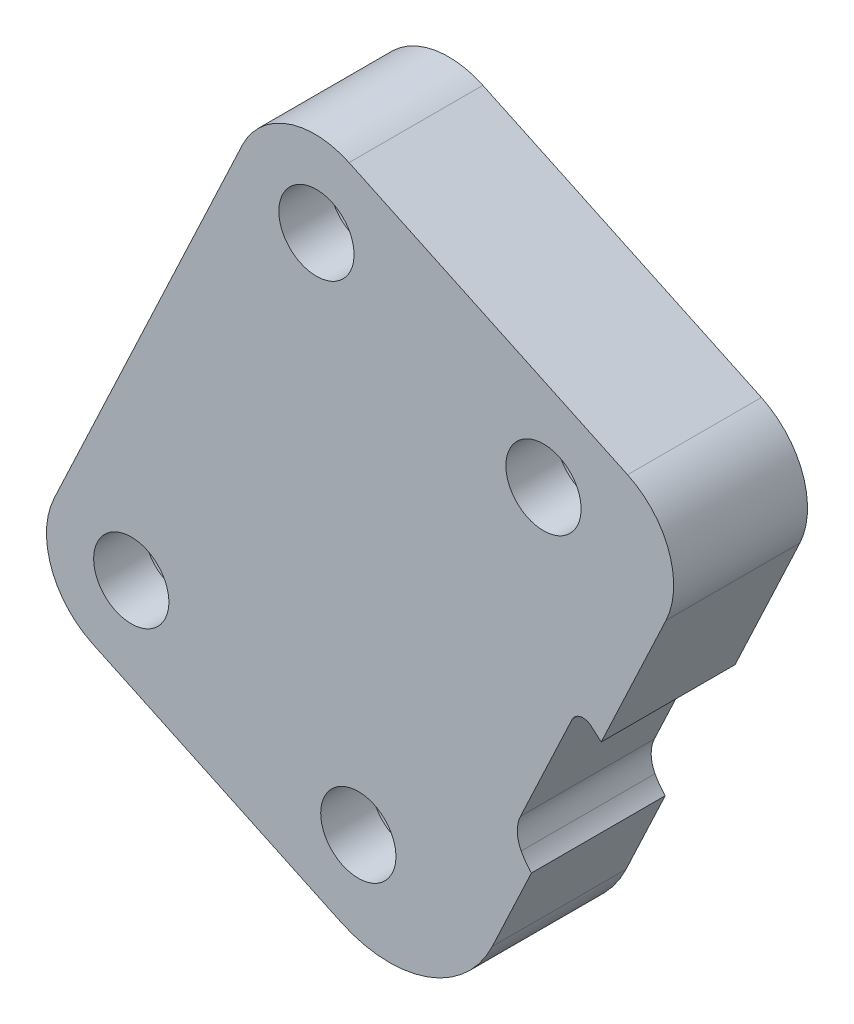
SolidWorks part; units mm, degrees
ref_plane "Front" through (0, 0, 0) normal (0, 0, 1) x (1, 0, 0)
ref_plane "Top" through (0, 0, 0) normal (0, 1, 0) x (1, 0, 0)
ref_plane "Right" through (0, 0, 0) normal (1, 0, 0) x (0, 0, -1)
ref_plane "Plane1"
sketch "Sketch1" plane through (0, 0, 3.2) normal (0, 0, -1) x (-1, 0, 0)
  line L0 (347.0241, 7.1484) -> (363.5162, -27.9003)
  line L1 (350.6746, 17.2876) -> (377.1047, 29.7243)
  line L2 (377.8801, -33.0718) -> (401.4374, -21.9869)
  line L3 (387.2439, 26.0738) -> (405.0878, -11.8477)
  line L4 (375.8975, -10.9615) -> (369.3196, 3.0178) construction
  line L5 (360.5195, -15.5659) -> (355.9692, -5.8959) construction
  line L6 (360.5195, -15.5659) -> (355.9692, -5.8959) construction
  line L8 (358.2444, -10.7309) -> (386.4628, 2.5473) construction
  arc A0 (377.1047, 29.7243) -> (387.2439, 26.0738) centre (380.3491, 22.8295) cw
  arc A1 (401.4374, -21.9869) -> (405.0878, -11.8477) centre (398.193, -15.0921) ccw
  arc A3 (363.5162, -27.9003) -> (377.8801, -33.0718) centre (373.2839, -23.3041) ccw
  arc A4 (347.0241, 7.1484) -> (350.6746, 17.2876) centre (353.9189, 10.3928) cw
extrude "Boss-Extrude1" add sketch "Sketch1" against normal blind 12.7 flip side to cut
sketch "Sketch2" plane through (0, 0, 28.6) normal (0, 0, 1) x (1, 0, 0)
  line L0 (-354.2397, -5.2075) -> (-351.2631, -7.7925)
  line L1 (-354.2397, -5.2075) -> (-351.2631, -7.7925) construction
  line L2 (-360.6884, -15.925) -> (-355.8003, -5.5368)
  line L3 (-360.6884, -15.925) -> (-355.8003, -5.5368) construction
  line L4 (-360.8332, -15.8569) -> (-355.9451, -5.4686)
  line L5 (-354.1348, -5.0867) -> (-351.1581, -7.6717)
  line L6 (-353.5434, -21.301) -> (-351.1581, -7.6717)
  arc A0 (-354.2397, -5.2075) -> (-355.8003, -5.5368) centre (-354.8954, -5.9625) ccw
  arc A1 (-354.2397, -5.2075) -> (-355.8003, -5.5368) centre (-354.8954, -5.9625) ccw construction
  arc A2 (-360.6258, -18.602) -> (-353.6039, -21.1528) centre (-355.7059, -15.999) ccw
  arc A3 (-360.6258, -18.602) -> (-353.6039, -21.1528) centre (-355.7059, -15.999) ccw construction
  arc A4 (-360.6884, -15.925) -> (-360.6258, -18.602) centre (-357.9773, -17.2007) ccw
  arc A5 (-360.6884, -15.925) -> (-360.6258, -18.602) centre (-357.9773, -17.2007) ccw construction
  arc A6 (-360.7672, -18.6768) -> (-353.5434, -21.301) centre (-355.7059, -15.999) ccw
  arc A7 (-360.8332, -15.8569) -> (-360.7672, -18.6768) centre (-357.9773, -17.2007) ccw
  arc A8 (-354.1348, -5.0867) -> (-355.9451, -5.4686) centre (-354.8954, -5.9625) ccw
  dimension "D1" = 0.16
extrude "Cut-Extrude1" cut sketch "Sketch2" against normal through all
hole_wizard "Hole1" positions "Point_Sketch" profile "Profil_Sketch" counterbore size "1/4" standard "ANSI Inch"
sketch "Point_Sketch" plane through (-303.714, 30.7531, 3.2) normal (0, 0, 1) x (-1, 0, 0)
  point P0 (76.483, 8.3461)
  point P2 (72.5103, 55.8316)
  point P4 (94.0566, 45.693)
  point P6 (54.9367, 18.4847)
sketch "Profil_Sketch" plane through (-380.197, 22.407, 3.2) normal (1, 0, 0) x (0, 1, 0)
  line L0 (0, 0) -> (0, 12.7)
  line L1 (0, 12.7) -> (3.5687, 12.7)
  line L3 (3.5687, 12.7) -> (3.5687, 7.874)
  line L4 (3.5687, 7.874) -> (5.3594, 7.874)
  line L5 (5.3594, 7.874) -> (5.3594, 0)
  line L7 (5.3594, 0) -> (0, 0)
  line L11 (0, -6.35) -> (0, 107.95) construction
  dimension "Diameter" = 7.1374
  dimension "Thru Hole Depth" = 12.7
  dimension "L1" = 7.874
other "usin_LS160_.25-20x.625-SHCS<1>"
